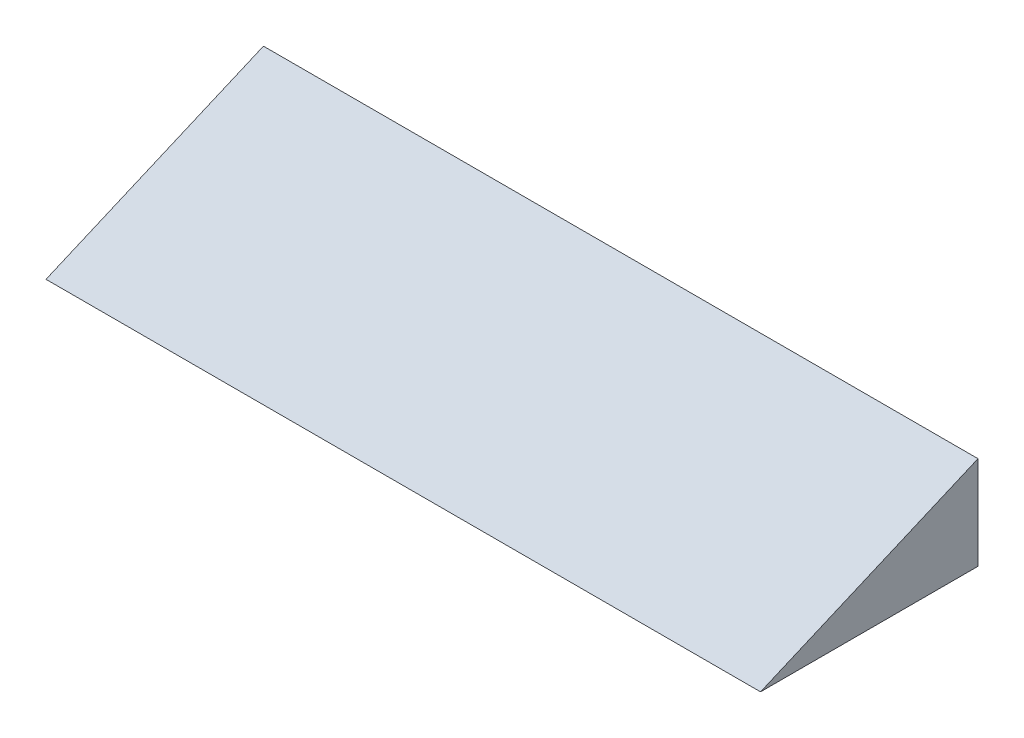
SolidWorks part; units mm, degrees
ref_plane "Front Plane" through (0, 0, 0) normal (0, 0, 1) x (1, 0, 0)
ref_plane "Top Plane" through (0, 0, 0) normal (0, 1, 0) x (1, 0, 0)
ref_plane "Right Plane" through (0, 0, 0) normal (1, 0, 0) x (0, 0, -1)
sketch "Sketch1" plane through (0, 0, 0) normal (1, 0, 0) x (0, 0, -1)
  line L0 (0, 0) -> (0, 38.1)
  line L1 (0, 38.1) -> (-88.9, 0)
  line L2 (-88.9, 0) -> (0, 0)
  dimension "D1" = 38.1
  dimension "D2" = 88.9
extrude "Extrude1" add sketch "Sketch1" along normal blind 292.1
